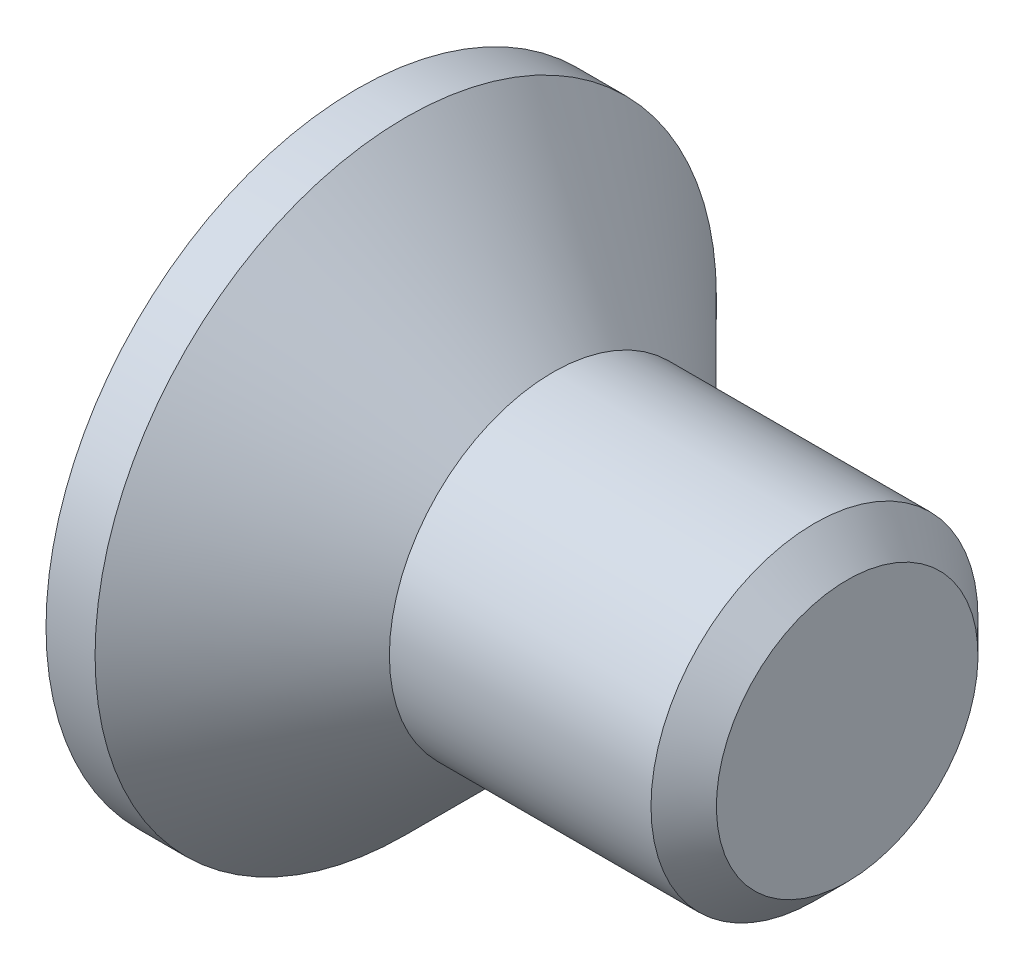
SolidWorks part; units mm, degrees
ref_plane "Front Plane" through (0, 0, 0) normal (0, 0, 1) x (1, 0, 0)
ref_plane "Top Plane" through (0, 0, 0) normal (0, 1, 0) x (1, 0, 0)
ref_plane "Right Plane" through (0, 0, 0) normal (1, 0, 0) x (0, 0, -1)
sketch "Sketch1" plane through (0, 0, 0) normal (0, 0, 1) x (1, 0, 0)
  line L1 (-1.2, 1.9) -> (-1.2, 0)
  line L2 (-1.2, 0) -> (1.8, 0)
  line L3 (1.8, 0) -> (1.8, 1)
  line L4 (1.8, 1) -> (0, 1)
  line L5 (-1.2, 1.9) -> (-0.9, 1.9)
  line L6 (-0.9, 1.9) -> (0, 1)
  dimension "D1" = 1
  dimension "D2" = 45
  dimension "D3" = 1.2
  dimension "D4" = 3
  dimension "D5" = 1.9
revolve "Revolve1" add sketch "Sketch1" angle 360 about L2
chamfer "Chamfer1" distance 0.2 angle 45 1 edges at (1.8, -1, 0)
sketch "Sketch2" plane through (-1.2, 0, 0) normal (-1, 0, 0) x (0, 0, 1)
  line L0 (-0.3, 1.175) -> (0.3, 1.175)
  line L1 (0.3, 1.175) -> (0.3, 0.3)
  line L2 (0.3, 0.3) -> (1.175, 0.3)
  line L3 (1.175, 0.3) -> (1.175, -0.3)
  line L4 (1.175, -0.3) -> (0.3, -0.3)
  line L5 (0.3, -0.3) -> (0.3, -1.175)
  line L6 (0.3, -1.175) -> (-0.3, -1.175)
  line L7 (-0.3, -1.175) -> (-0.3, -0.3)
  line L8 (-0.3, -0.3) -> (-1.175, -0.3)
  line L9 (-1.175, -0.3) -> (-1.175, 0.3)
  line L10 (-1.175, 0.3) -> (-0.3, 0.3)
  line L11 (-0.3, 0.3) -> (-0.3, 1.175)
  point P5 (0, 1.175)
  point P13 (1.175, 0)
  point P15 (-1.175, 0)
  point P16 (0, -1.175)
  point P17 (0.3, 1.085)
  dimension "D1" = 0.6
  dimension "D2" = 2.35
extrude "Cut-Extrude1" cut sketch "Sketch2" against normal blind 0.95
